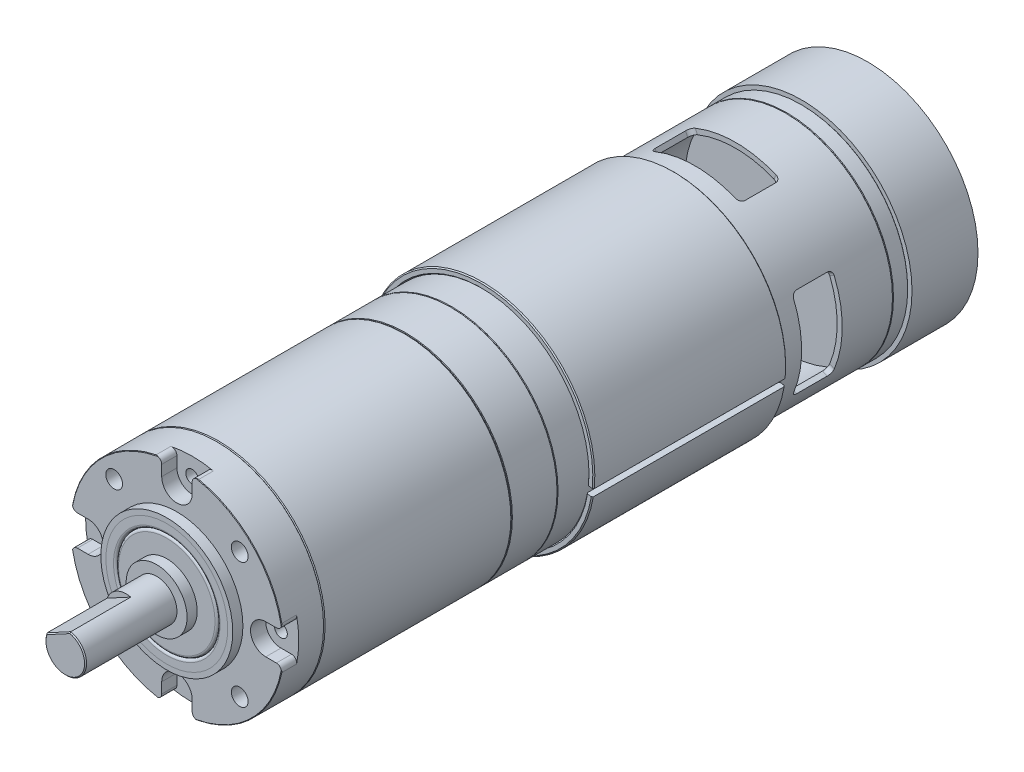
SolidWorks part; units mm, degrees
other "CHP-42GP-775-1-sólido1"
other "CHP-42GP-775-1-sólido2"
other "CHP-42GP-775-1-sólido3"
other "CHP-42GP-775-1-sólido4"
other "CHP-42GP-775-1-sólido5"
other "CHP-42GP-775-1-sólido6"
other "CHP-42GP-775-1-sólido7"
other "CHP-42GP-775-1-sólido8"
other "CHP-42GP-775-Shift-1-sólido1"
other "CHP-42GP-775-保護套-1-sólido1"
ref_plane "Front Plane" through (0, 0, 0) normal (0, 0, 1) x (1, 0, 0)
ref_plane "Top Plane" through (0, 0, 0) normal (0, 1, 0) x (1, 0, 0)
ref_plane "Right Plane" through (0, 0, 0) normal (1, 0, 0) x (0, 0, -1)
other "Hacer pieza multicuerpo1"
